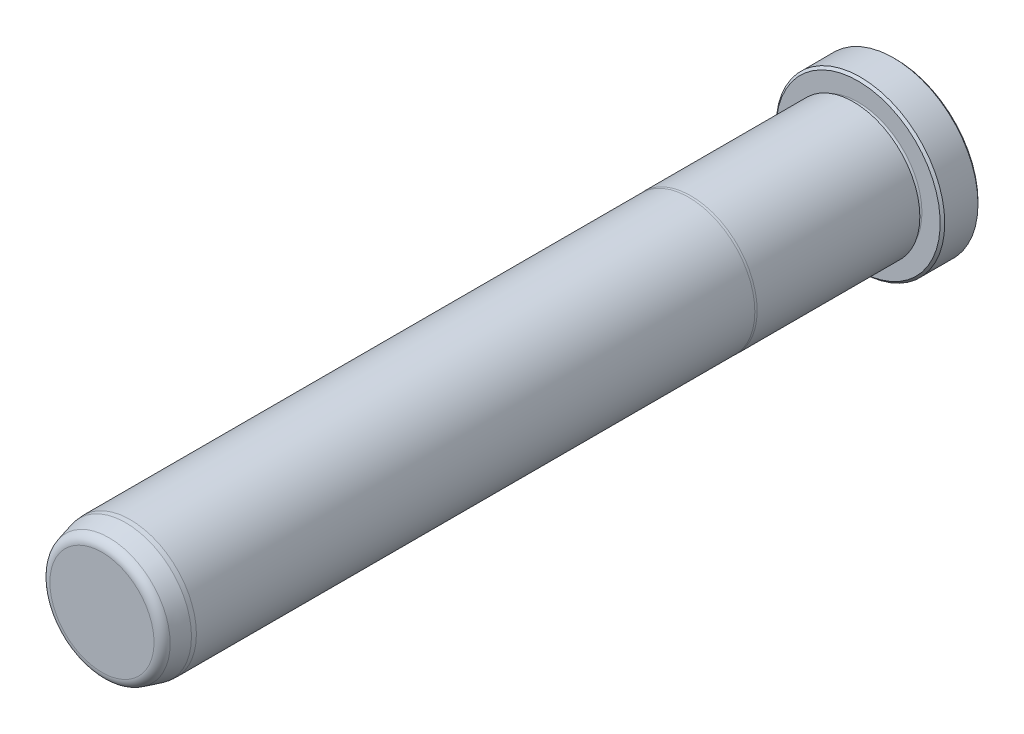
SolidWorks part; units mm, degrees
ref_plane "Front Plane" through (0, 0, 0) normal (0, 0, 1) x (1, 0, 0)
ref_plane "Top Plane" through (0, 0, 0) normal (0, 1, 0) x (1, 0, 0)
ref_plane "Right Plane" through (0, 0, 0) normal (1, 0, 0) x (0, 0, -1)
sketch "Sketch1" plane through (0, 0, 0) normal (1, 0, 0) x (0, 0, -1)
  line L0 (0, 0) -> (0, 14.1605)
  line L1 (0, 14.1605) -> (-6.35, 14.1605)
  line L2 (-6.35, 14.1605) -> (-6.35, 10.7188)
  line L3 (-6.35, 10.3378) -> (-7.112, 10.3378) construction
  line L4 (-7.112, 10.7188) -> (-7.112, 11.1252)
  line L5 (-7.112, 11.1252) -> (-34.4348, 11.1252)
  line L6 (-34.4348, 11.1252) -> (-34.798, 11.0998)
  line L7 (-34.798, 11.0998) -> (-128.5875, 11.0998)
  line L9 (-133.35, 9.9612) -> (-133.35, 0)
  line L10 (-133.35, 0) -> (0, 0)
  line L11 (0, 0) -> (13.6287, 0) construction
  line L12 (-128.5875, 11.0998) -> (-129.3495, 11.0331)
  line L13 (-129.3495, 11.0331) -> (-133.35, 9.9612)
  arc A0 (-7.112, 10.7188) -> (-6.35, 10.7188) centre (-6.731, 10.7188) ccw
  dimension "D14" = 0.762
  dimension "D1" = 6.35
  dimension "D2" = 0.762
  dimension "D3" = 28.321
  dimension "D4" = 22.2504
  dimension "D5" = 34.798
  dimension "D6" = 133.35
  dimension "D7" = 0.7874
  dimension "D8" = 4
  dimension "D9" = 22.1996
  dimension "D10" = 5
  dimension "D11" = 15
  dimension "D12" = 0.762
  dimension "D13" = 4.7625
revolve "Revolve1" add sketch "Sketch1" angle 360 about L11
fillet "Fillet6" radius 1.5875 1 edges at (9.9612, 0, 133.35)
chamfer "Chamfer1" distance 0.381 angle 45 2 edges at (14.1605, 0, 0) (14.1605, 0, 6.35)
